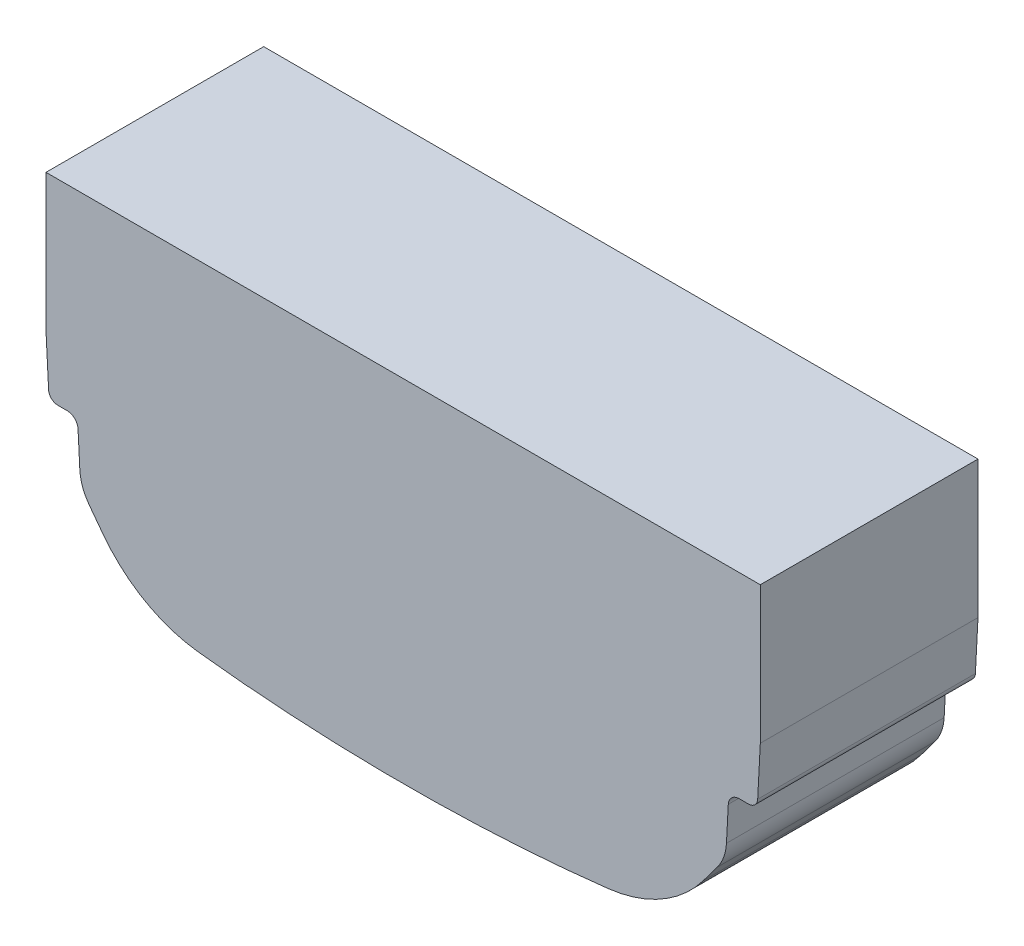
SolidWorks part; units mm, degrees
ref_plane "Front Plane" through (0, 0, 0) normal (0, 0, 1) x (1, 0, 0)
ref_plane "Top Plane" through (0, 0, 0) normal (0, 1, 0) x (1, 0, 0)
ref_plane "Right Plane" through (0, 0, 0) normal (1, 0, 0) x (0, 0, -1)
ref_plane "Plane1" through (0, 0, 64.75) normal (0, 0, 1) x (1, 0, 0)
sketch "Sketch1" plane through (0, 0, 64.75) normal (0, 0, 1) x (1, 0, 0)
  line L0 (212.4535, -16) -> (-212.4535, -16)
  line L1 (-212.4535, -16) -> (-212.4535, -97.6598)
  line L2 (-212.4535, -97.6598) -> (-210.9007, -127.2878)
  line L3 (-205.4083, -132.5) -> (-199.8922, -132.5)
  line L4 (-193.4011, -138.6598) -> (-192.3214, -159.2611)
  line L5 (192.3214, -159.2611) -> (193.4011, -138.6598)
  line L6 (199.8922, -132.5) -> (205.4083, -132.5)
  line L7 (210.9007, -127.2878) -> (212.4535, -97.6598)
  line L8 (212.4535, -97.6598) -> (212.4535, -16)
  arc A0 (-210.9007, -127.2878) -> (-205.4083, -132.5) centre (-205.4083, -127) ccw
  arc A1 (-199.8922, -132.5) -> (-193.4011, -138.6598) centre (-199.8922, -139) cw
  arc A2 (-192.3214, -159.2611) -> (-186.8745, -174.3013) centre (-164.8591, -157.8219) ccw
  arc A3 (-186.8745, -174.3013) -> (-178.5522, -185.3824) centre (3277.9408, 2419.2418) ccw
  arc A4 (-178.5522, -185.3824) -> (-122.2134, -217.7426) centre (-112.5, -135.609) ccw
  arc A5 (122.2134, -217.7426) -> (178.5522, -185.3824) centre (112.5, -135.609) ccw
  arc A6 (178.5522, -185.3824) -> (186.8745, -174.3013) centre (-3277.9407, 2419.2418) ccw
  arc A7 (186.8745, -174.3013) -> (192.3214, -159.2611) centre (164.8591, -157.8219) ccw
  arc A8 (193.4011, -138.6598) -> (199.8922, -132.5) centre (199.8922, -139) cw
  arc A9 (205.4083, -132.5) -> (210.9007, -127.2878) centre (205.4083, -127) ccw
  spline S0 degree 3 poles (-122.2134, -217.7426) (-101.9459, -220.1395) (-61.2501, -223.5888) (0.0113, -225.2649) (61.2697, -223.5875) (101.9514, -220.1389) (122.2134, -217.7426) knots 0 0 0 0 0.25 0.5 0.75 1 1 1 1
extrude "Boss-Extrude1" add sketch "Sketch1" against normal blind 129.5
